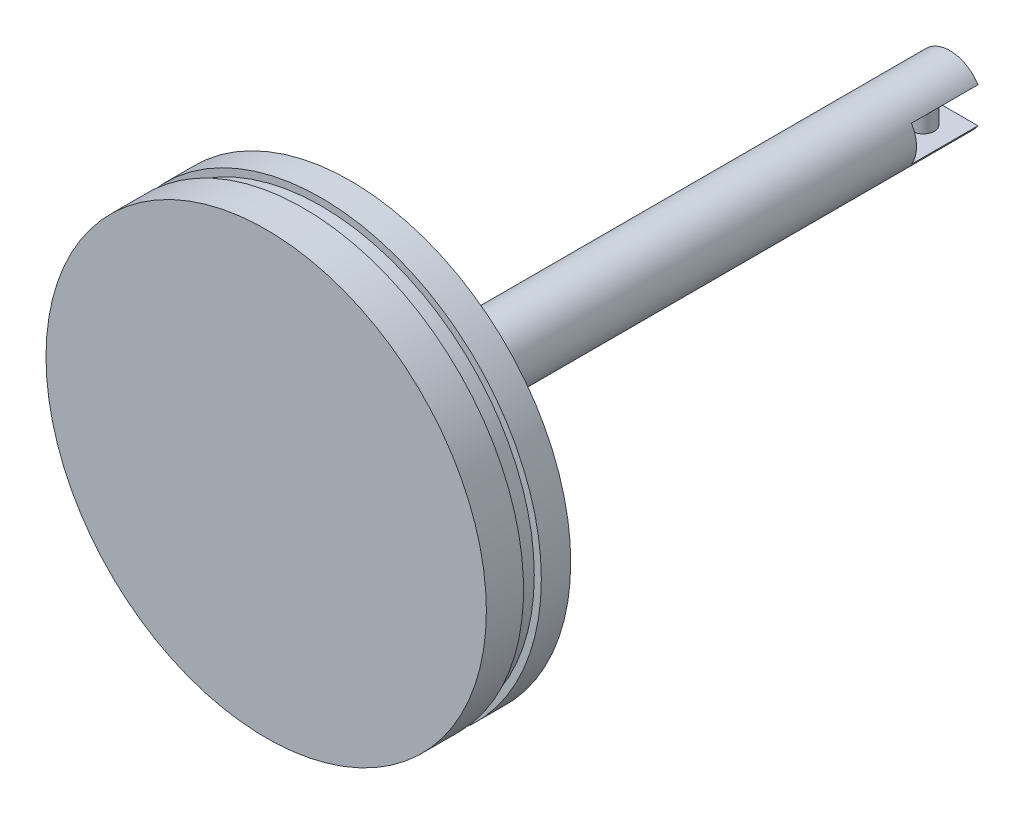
SolidWorks part; units mm, degrees
ref_plane "Front Plane" through (0, 0, 0) normal (0, 0, 1) x (1, 0, 0)
ref_plane "Top Plane" through (0, 0, 0) normal (0, 1, 0) x (1, 0, 0)
ref_plane "Right Plane" through (0, 0, 0) normal (1, 0, 0) x (0, 0, -1)
sketch "Sketch1" plane through (0, 0, 0) normal (0, 0, 1) x (1, 0, 0)
  circle A0 centre (0, 0) radius 49.6
  dimension "D1" = 99.2
extrude "Boss-Extrude1" add sketch "Sketch1" along normal blind 3
sketch "Sketch2" plane through (0, 0, 0) normal (0, 0, 1) x (1, 0, 0)
  circle A0 centre (0, 0) radius 49.6
  circle A1 centre (0, 0) radius 46
  dimension "D1" = 92
extrude "Boss-Extrude2" add sketch "Sketch2" along normal blind 15
ref_plane "Plane1" through (0, 0, 15) normal (0, 0, 1) x (1, 0, 0)
sketch "Sketch3" plane through (0, 0, 15) normal (0, 0, 1) x (1, 0, 0)
  circle A0 centre (0, 0) radius 49.6
extrude "Boss-Extrude3" add sketch "Sketch3" along normal blind 4
sketch "Sketch4" plane through (0, 0, 3) normal (0, 0, 1) x (1, 0, 0)
  circle A0 centre (-35.9876, -3.6797) radius 2.5
  circle A1 centre (-20.9712, -26.3718) radius 2.5
  circle A2 centre (10.7974, -30.7469) radius 2.5
  circle A3 centre (29.0283, -5.2297) radius 2.5
  circle A4 centre (17.4025, 21.9192) radius 2.5
  circle A5 centre (-12.5554, 26.333) radius 2.5
  circle A6 centre (0, 0) radius 5
  dimension "D1" = 5
  dimension "D2" = 5
  dimension "D3" = 5
  dimension "D4" = 5
  dimension "D5" = 5
  dimension "D6" = 5
  dimension "D7" = 10
extrude "Boss-Extrude4" add sketch "Sketch4" along normal blind 16
sketch "Sketch5" plane through (0, 0, 0) normal (0, 0, 1) x (1, 0, 0)
  circle A0 centre (0, 0) radius 7.5
  dimension "D1" = 15
extrude "Boss-Extrude5" add sketch "Sketch5" against normal blind 135
sketch "Sketch6" plane through (0, 0, 0) normal (1, 0, 0) x (0, 0, -1)
  line L0 (0, 0) -> (-20.0762, 0) construction
  line L1 (-6.6203, -50.8877) -> (-10.6203, -50.8877)
  line L2 (-6.6203, -50.8877) -> (-6.6203, -48.0104)
  line L3 (-6.6203, -48.0104) -> (-10.6203, -48.0104)
  line L4 (-10.6203, -50.8877) -> (-10.6203, -48.0104)
  dimension "D1" = 4
revolve "Cut-Revolve1" cut sketch "Sketch6" angle 360 about L0
ref_plane "Plane2" through (0, 0, -135) normal (0, 0, -1) x (-1, 0, 0)
sketch "Sketch7" plane through (0, 0, -135) normal (0, 0, -1) x (-1, 0, 0)
  line L0 (10.6083, 4) -> (-10.6083, 4)
  line L1 (10.6083, 4) -> (10.6083, -4)
  line L2 (-10.6083, 4) -> (-10.6083, -4)
  line L3 (10.6083, -4) -> (-10.6083, -4)
  line L4 (10.6083, 4) -> (-10.6083, -4) construction
  line L5 (-10.6083, 4) -> (10.6083, -4) construction
  point P1 (0, 0)
  dimension "D1" = 8
extrude "Cut-Extrude1" cut sketch "Sketch7" against normal blind 15
ref_plane "Plane3" through (0, -4, 0) normal (0, 1, 0) x (1, 0, 0)
sketch "Sketch8" plane through (0, -4, 0) normal (0, 1, 0) x (1, 0, 0)
  line L0 (8.25, 135) -> (-8.25, 135) construction
  circle A0 centre (0, 129) radius 2.5
  dimension "D1" = 5
  dimension "D2" = 6
extrude "Boss-Extrude6" add sketch "Sketch8" along normal blind 10
